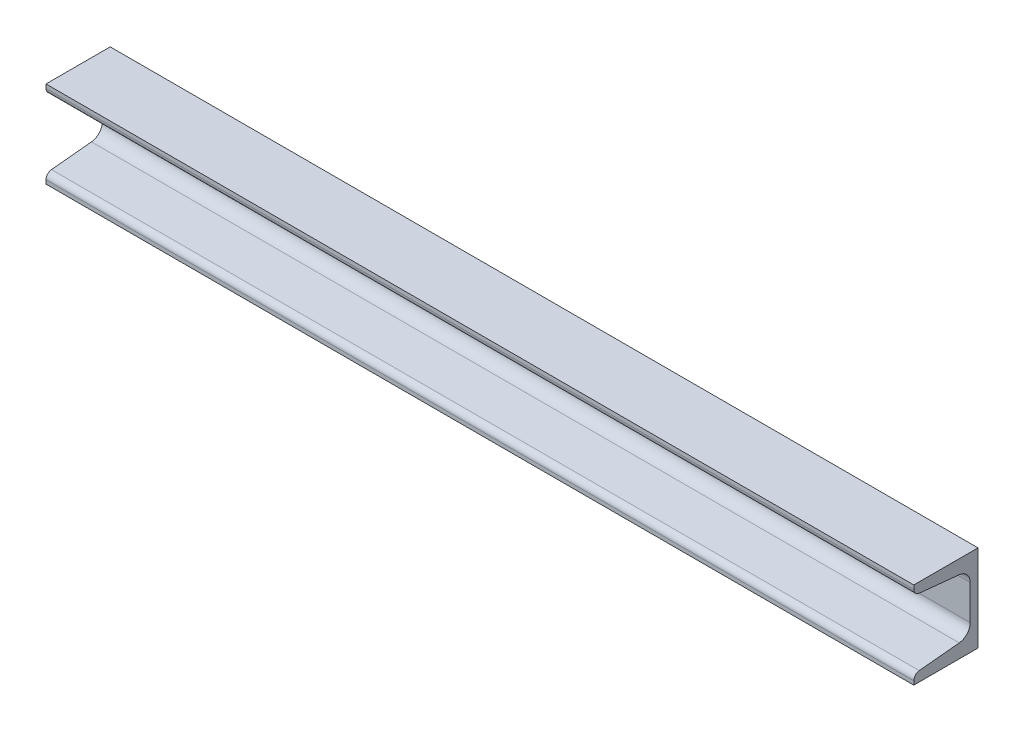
SolidWorks part; units mm, degrees
ref_plane "Front" through (0, 0, 0) normal (0, 0, 1) x (1, 0, 0)
ref_plane "Top" through (0, 0, 0) normal (0, 1, 0) x (1, 0, 0)
ref_plane "Right" through (0, 0, 0) normal (1, 0, 0) x (0, 0, -1)
sketch "Sketch1" plane through (0, 0, -28.2113) normal (1, 0, 0) x (0, 0, 1)
  line L0 (28.2113, -25) -> (28.2113, 25)
  line L1 (28.2113, 25) -> (65.2113, 25)
  line L2 (-69.1718, 0) -> (97.3831, 0) construction
  line L3 (32.7113, 16.375) -> (32.7113, -16.375)
  line L4 (32.7113, 16.375) -> (65.2113, 19.625)
  line L5 (65.2113, 19.625) -> (65.2113, 25)
  line L6 (32.7113, 16.375) -> (32.7113, 19.625) construction
  line L7 (32.7113, 19.625) -> (65.2113, 19.625) construction
  line L8 (48.9613, 25) -> (48.9613, 18) construction
  line L9 (65.2113, -19.625) -> (65.2113, -25)
  line L10 (28.2113, -25) -> (65.2113, -25)
  line L11 (32.7113, -16.375) -> (65.2113, -19.625)
  point P15 (28.2113, 0)
  point P16 (32.7113, 0)
  dimension "D1" = 16.25
  dimension "h" = 50
  dimension "b" = 37
  dimension "d" = 4.5
  dimension "t" = 7
  dimension "D6" = 3.25
extrude "Base" add sketch "Sketch1" along normal blind 500
fillet "Fillet1" radius 7 2 edges at (250, -16.375, 4.5) (250, 16.375, 4.5)
fillet "Fillet2" radius 3.5 2 edges at (250, -19.625, 37) (250, 19.625, 37)
equation "\"D1@Sketch1\" =  ( \"b@Sketch1\" - \"d@Sketch1\" )  / 2"
equation "\"D6@Sketch1\" = ( \"b@Sketch1\" - \"d@Sketch1\" )  / 10"
